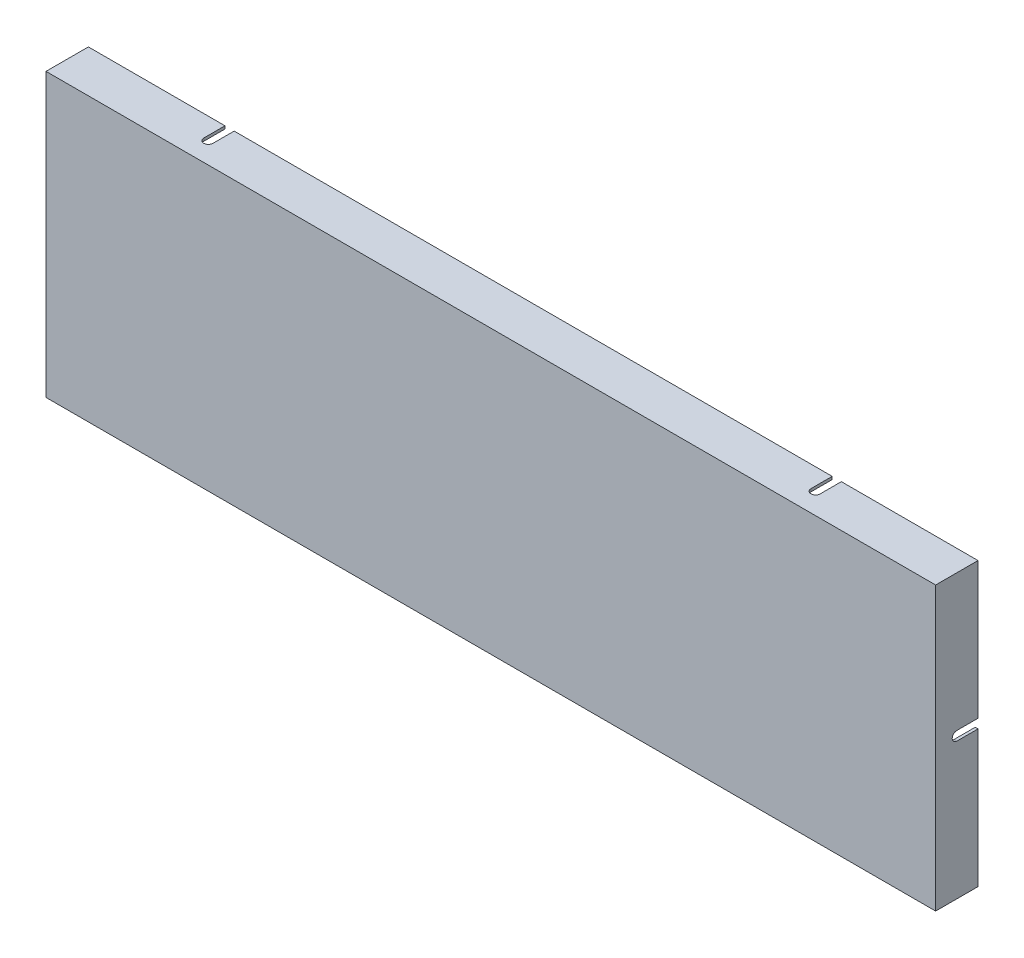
SolidWorks part; units mm, degrees
ref_plane "前基準面" through (0, 0, 0) normal (0, 0, 1) x (1, 0, 0)
ref_plane "上基準面" through (0, 0, 0) normal (0, 1, 0) x (1, 0, 0)
ref_plane "右基準面" through (0, 0, 0) normal (1, 0, 0) x (0, 0, -1)
sketch "草圖1" plane through (0, 0, 0) normal (0, 0, 1) x (1, 0, 0)
  line L1 (0, 0) -> (630, 0)
  line L2 (0, 0) -> (0, -200)
  line L3 (0, -200) -> (630, -200)
  line L4 (630, 0) -> (630, -200)
  dimension "D1" = 630
  dimension "D2" = 200
extrude "填料-伸長1" add sketch "草圖1" along normal blind 30
shell "薄殼2" thickness 2
sketch "草圖5" plane through (0, 0, 0) normal (0, 1, 0) x (1, 0, 0)
  line L0 (100, 0) -> (100, -15) construction
  line L1 (630, 0) -> (0, 0) construction
  line L2 (103.25, 0) -> (103.25, -15)
  line L3 (96.75, 0) -> (96.75, -15)
  line L4 (530, 0) -> (530, -15) construction
  line L5 (533.25, 0) -> (533.25, -15)
  line L6 (526.75, 0) -> (526.75, -15)
  line L7 (0, -30) -> (0, 0) construction
  line L8 (630, -30) -> (630, 0) construction
  arc A0 (103.25, 0) -> (96.75, 0) centre (100, 0) ccw
  arc A1 (96.75, -15) -> (103.25, -15) centre (100, -15) ccw
  arc A2 (533.25, 0) -> (526.75, 0) centre (530, 0) ccw
  arc A3 (526.75, -15) -> (533.25, -15) centre (530, -15) ccw
  point P4 (100, -7.5)
  point P9 (530, -7.5)
  dimension "D1" = 3.25
  dimension "D2" = 3.25
  dimension "D3" = 15
  dimension "D4" = 15
  dimension "D5" = 100
  dimension "D6" = 100
extrude "除料-伸長2" cut sketch "草圖5" against normal through all
sketch "草圖6" plane through (0, 0, 0) normal (-1, 0, 0) x (0, 0, 1)
  line L0 (0, -100) -> (15, -100) construction
  line L1 (0, 0) -> (0, -200) construction
  line L2 (0, -96.75) -> (15, -96.75)
  line L3 (0, -103.25) -> (15, -103.25)
  arc A0 (0, -96.75) -> (0, -103.25) centre (0, -100) ccw
  arc A1 (15, -103.25) -> (15, -96.75) centre (15, -100) ccw
  point P4 (7.5, -100)
  dimension "D2" = 3.25
  dimension "D1" = 15
extrude "除料-伸長3" cut sketch "草圖6" against normal through all
